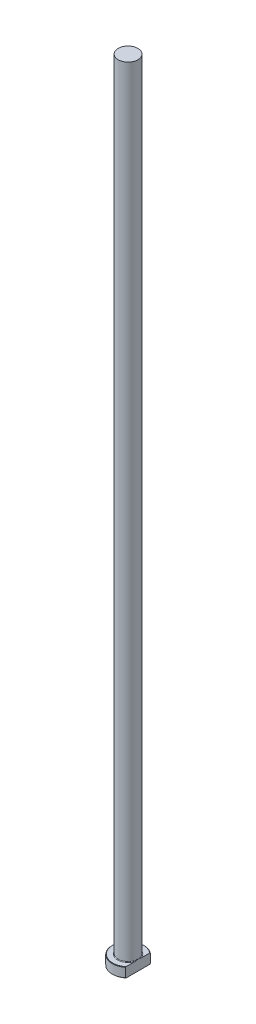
SolidWorks part; units mm, degrees
ref_plane "Front Plane" through (0, 0, 0) normal (0, 0, 1) x (1, 0, 0)
ref_plane "Top Plane" through (0, 0, 0) normal (0, 1, 0) x (1, 0, 0)
ref_plane "Right Plane" through (0, 0, 0) normal (1, 0, 0) x (0, 0, -1)
sketch "Sketch1" plane through (0, 0, 0) normal (0, 0, 1) x (1, 0, 0)
  line L0 (0, 259.9588) -> (0, -15.1925) construction
  line L1 (0, 0) -> (-8, 0)
  line L2 (-8, 0) -> (-8, 5)
  line L3 (-8, 5) -> (-5, 5)
  line L4 (-5, 5) -> (-5, 400)
  line L5 (-5, 400) -> (0, 400)
  line L6 (0, 400) -> (0, 0)
  dimension "L" = 400
  dimension "H" = 16
  dimension "T" = 5
  dimension "D" = 10
revolve "Revolve1" add sketch "Sketch1" angle 360 about L0
chamfer "Chamfer1" distance 0.2 angle 45 2 edges at (0, 5, 8) (0, 0, 8)
fillet "Fillet1" radius 0.3 1 edges at (0, 5, 5)
sketch "Sketch2" plane through (0, 0, 0) normal (0, 1, 0) x (1, 0, 0)
  line L0 (5, 6.245) -> (5, -6.245)
  circle A0 centre (0, 0) radius 8 construction
  arc A1 (5, -6.245) -> (5, 6.245) centre (0, 0) ccw
  circle A2 centre (0, 0) radius 5 construction
extrude "KEY" cut sketch "Sketch2" along normal through all
